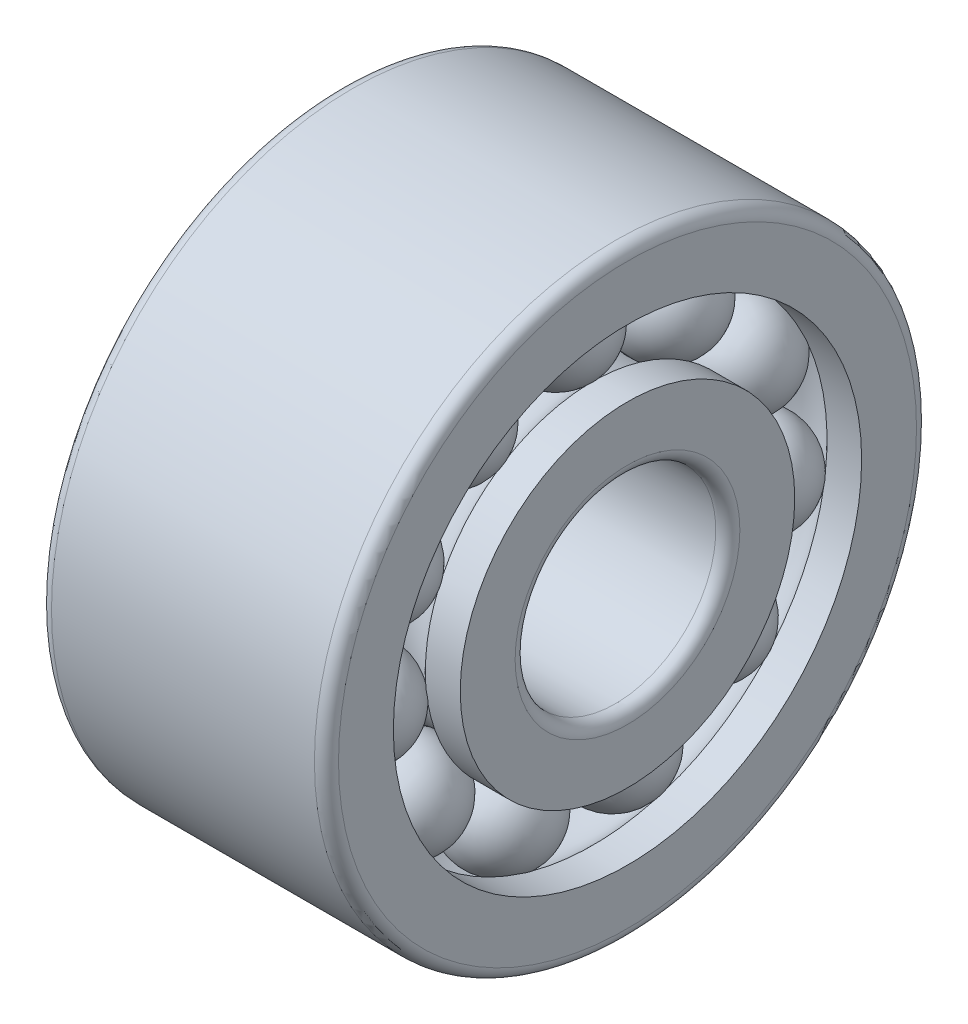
SolidWorks part; units mm, degrees
ref_plane "Front" through (0, 0, 0) normal (0, 0, 1) x (1, 0, 0)
ref_plane "Top" through (0, 0, 0) normal (0, 1, 0) x (1, 0, 0)
ref_plane "Right" through (0, 0, 0) normal (1, 0, 0) x (0, 0, -1)
sketch "Sketch1" plane through (0, 0, 0) normal (0, 0, 1) x (1, 0, 0)
  line L0 (-7.15, 5) -> (7.15, 5)
  line L1 (7.15, 5) -> (7.15, 8.3333)
  line L2 (7.15, 8.3333) -> (5.4115, 8.3333)
  line L3 (-7.15, 8.3333) -> (-7.15, 5)
  line L4 (-17.2026, 0) -> (19.471, 0) construction
  line L5 (-8.8622, 10) -> (12.5675, 10) construction
  line L6 (-5.4115, 8.3333) -> (-7.15, 8.3333)
  line L7 (1.7385, 8.3333) -> (-1.7385, 8.3333) construction
  arc A0 (-5.4115, 8.3333) -> (-1.7385, 8.3333) centre (-3.575, 10) ccw
  arc A1 (1.7385, 8.3333) -> (5.4115, 8.3333) centre (3.575, 10) ccw
  arc A2 (-1.7385, 8.3333) -> (1.7385, 8.3333) centre (0, 12.9787) ccw
  dimension "D3" = 2.48
  dimension "D4" = 7.15
  dimension "D7" = 4.96
  dimension "D1" = 7.15
  dimension "d" = 10
  dimension "D2" = 16.6667
  dimension "B" = 14.3
  dimension "D5" = 10
  dimension "D6" = 3.575
revolve "Revolve1" add sketch "Sketch1" angle 360 about L4
sketch "Sketch2" plane through (0, 0, 0) normal (0, 0, 1) x (1, 0, 0)
  line L0 (-10.0989, 0) -> (10.8887, 0) construction
  line L2 (-10.0989, 10) -> (10.0671, 10) construction
  line L3 (-6.075, 10) -> (-1.075, 10)
  line L4 (1.075, 10) -> (6.075, 10)
  arc A0 (-6.075, 10) -> (-1.075, 10) centre (-3.575, 10) ccw
  arc A1 (1.075, 10) -> (6.075, 10) centre (3.575, 10) ccw
  dimension "D4" = 5
  dimension "D1" = 10
  dimension "D2" = 7.15
  dimension "D3" = 3.575
revolve "Revolve2" add sketch "Sketch2" angle 360 about L2
sketch "Sketch3" plane through (0, 0, 0) normal (0, 0, 1) x (1, 0, 0)
  line L0 (-7.15, 11.6667) -> (-7.15, 15)
  line L1 (-7.15, 15) -> (7.15, 15)
  line L2 (7.15, 15) -> (7.15, 11.6667)
  line L3 (7.15, 11.6667) -> (5.425, 11.6667)
  line L4 (-10.3666, 0) -> (11.6147, 0) construction
  line L6 (-9.6777, 10) -> (8.7392, 10) construction
  line L7 (1.725, 11.6667) -> (-1.725, 11.6667) construction
  line L8 (-5.425, 11.6667) -> (-7.15, 11.6667)
  arc A0 (-1.725, 11.6667) -> (-5.425, 11.6667) centre (-3.575, 10) ccw
  arc A1 (5.425, 11.6667) -> (1.725, 11.6667) centre (3.575, 10) ccw
  arc A2 (-1.725, 11.6667) -> (1.725, 11.6667) centre (0, 7.0163) cw
  arc A3 (-1.7385, 8.3333) -> (1.7385, 8.3333) centre (0, 12.9787) ccw construction
  dimension "D6" = 4.98
  dimension "D1" = 10
  dimension "D2" = 23.3333
  dimension "DD" = 30
  dimension "D3" = 7.15
  dimension "B" = 14.3
  dimension "D4" = 7.15
  dimension "D5" = 3.575
revolve "Revolve3" add sketch "Sketch3" angle 360 about L4
pattern_circular "Circular-Pattern1" count 11 over 360 about axis through (0, 0, 0) along (1, 0, 0) of "Revolve2"
fillet "Fillet1" radius 0.6 4 edges at (-7.15, 0, 5) (-7.15, 0, 15) (7.15, 0, 5) (7.15, 0, 15)
equation "\"D5@Sketch1\" = ( \"d@Sketch1\" + \"DD@Sketch3\"  )  / 4"
equation "\"D4@Sketch1\" = \"B@Sketch1\" / 2"
equation "\"D2@Sketch1\" = \"d@Sketch1\" + ( \"DD@Sketch3\" - \"d@Sketch1\" )  / 3"
equation "\"D3@Sketch1\" =  ( \"DD@Sketch3\" - \"d@Sketch1\" )  / 8 - 0.02"
equation "\"D1@Sketch1\" = \"B@Sketch1\" / 2"
equation "\"D6@Sketch1\" = \"D1@Sketch1\" / 2"
equation "\"D1@Sketch2\" = ( \"d@Sketch1\" + \"DD@Sketch3\"  )  / 4"
equation "\"D2@Sketch2\" = \"B@Sketch1\" / 2"
equation "\"D3@Sketch2\" = \"D2@Sketch2\" / 2"
equation "\"D4@Sketch2\" =  ( \"DD@Sketch3\" - \"d@Sketch1\" )  / 4"
equation "\"D1@Sketch3\" = ( \"d@Sketch1\" + \"DD@Sketch3\"  )  / 4"
equation "\"B@Sketch3\" = \"B@Sketch1\""
equation "\"D4@Sketch3\" = \"B@Sketch3\" / 2"
equation "\"D2@Sketch3\" = \"DD@Sketch3\" - ( \"DD@Sketch3\" - \"d@Sketch1\"  )  / 3"
equation "\"D6@Sketch3\" =  ( \"DD@Sketch3\" - \"d@Sketch1\" )  / 4 - 0.02"
equation "\"D3@Sketch3\" = \"B@Sketch1\" / 2"
equation "\"D5@Sketch3\" = \"D3@Sketch3\" / 2"
equation "\"m@Circular-Pattern1\" = int( 3.14159265 / atn((\"D4@Sketch2\"/2) / sqr(( \"d@Sketch1\" + \"DD@Sketch3\"  )  / 4 * ( \"d@Sketch1\" + \"DD@Sketch3\"  )  / 4 - (\"D4@Sketch2\"/2) *  (\"D4@Sketch2\"/2))))-1"
equation "\"D7@Sketch1\" = \"D3@Sketch1\" * 2"
